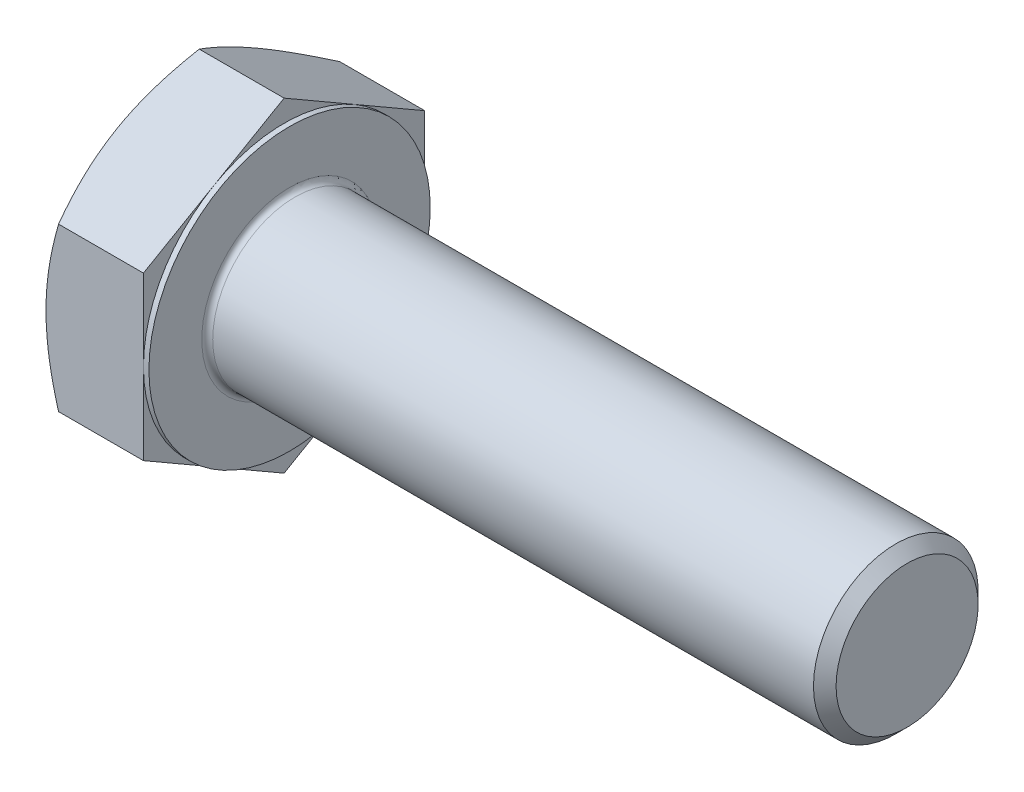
SolidWorks part; units mm, degrees
ref_plane "Front Plane" through (0, 0, 0) normal (0, 0, 1) x (1, 0, 0)
ref_plane "Top Plane" through (0, 0, 0) normal (0, 1, 0) x (1, 0, 0)
ref_plane "Right Plane" through (0, 0, 0) normal (1, 0, 0) x (0, 0, -1)
sketch "BaseHeadSke" plane through (0, 0, 0) normal (1, 0, 0) x (0, 0, -1)
  line L1 (20.5, 11.8357) -> (0, 23.6714)
  line L2 (0, 23.6714) -> (-20.5, 11.8357)
  line L3 (-20.5, 11.8357) -> (-20.5, -11.8357)
  line L4 (-20.5, -11.8357) -> (0, -23.6714)
  line L5 (0, -23.6714) -> (20.5, -11.8357)
  line L6 (20.5, -11.8357) -> (20.5, 11.8357)
  circle A0 centre (0, 0) radius 20.5 construction
  dimension "Width_flats" = 41
extrude "BaseHead" add sketch "BaseHeadSke" along normal blind 15
sketch "BodySke" plane through (0, 0, 0) normal (0, 0, 1) x (1, 0, 0)
  line L0 (0, 0) -> (105, 0)
  line L1 (105, 0) -> (105, 10.352)
  line L2 (105, 10.352) -> (103.352, 12)
  line L3 (103.352, 12) -> (0, 12)
  line L4 (0, 12) -> (0, 0)
  line L5 (15, 11.8357) -> (15, -11.8357) construction
  line L6 (0, 0) -> (159.3976, 0) construction
  line L7 (51, -84.3176) -> (51, 77.7215) construction
  line L8 (102, -21.5941) -> (102, 39.2994) construction
  dimension "Ang" = 45
  dimension "Length" = 90
  dimension "Diameter" = 24
  dimension "Minor_dia" = 20.704
  dimension "Thread_length" = 54
  dimension "Advance" = 3
revolve "BaseBody" add sketch "BodySke" angle 360 about L6
sketch "HeadChamferSke" plane through (0, 0, 0) normal (0, 0, 1) x (1, 0, 0)
  line L0 (1.831, 23.6714) -> (0, 23.6714)
  line L1 (0, 23.6714) -> (0, 20.5)
  line L2 (0, 20.5) -> (1.831, 23.6714)
  line L3 (0, 0) -> (120.9185, 0) construction
  dimension "D1" = 30
  dimension "Head_chamfer" = 41
revolve "HeadChamfer" cut sketch "HeadChamferSke" angle 360 about L3
sketch "BearingFaceSke" plane through (0, 0, 0) normal (0, 0, 1) x (1, 0, 0)
  line L0 (0, 0) -> (129.6443, 0) construction
  line L1 (14.2, 23.6714) -> (15, 23.6714)
  line L2 (14.2, 23.6714) -> (14.2, 20.5)
  line L3 (14.2, 20.5) -> (15, 20.5)
  line L4 (15, 23.6714) -> (15, 20.5)
  dimension "Bearing_height" = 0.8
  dimension "Dw" = 41
revolve "BearingFace" cut sketch "BearingFaceSke" angle 360 about L0
fillet "Fillet" radius 0.8 1 edges at (15, 0, -12)
sketch "ThdSchSke" plane through (0, 0, 0) normal (0, 0, 1) x (1, 0, 0)
  line L0 (101.0485, 13.9029) -> (101.0485, 12)
  line L1 (101.0485, 12) -> (102, 10.352)
  line L2 (102, 10.352) -> (102.9515, 12)
  line L3 (102.9515, 12) -> (102.9515, 13.9029)
  line L4 (102.9515, 13.9029) -> (101.0485, 13.9029)
  line L6 (0, 0) -> (141.9934, 0) construction
  line L7 (105, -10.352) -> (105, 10.352) construction
  dimension "D2" = 20.704
  dimension "D3" = 24
  dimension "Advance" = 3
revolve "ThreadSchematic" [suppressed] cut sketch "ThdSchSke" angle 360 about L6
pattern_linear "ThdSchPat" [suppressed] count 17 spacing 3 along (1, 0, 0)
equation "\"Thread_minor@ThreadCosmetic\" = \"Minor_dia@BodySke\""
equation "\"Thread_length@ThreadCosmetic\" = \"Thread_length@BodySke\""
equation "\"Head_chamfer@HeadChamferSke\" = \"Width_flats@BaseHeadSke\""
equation "\"D2@ThdSchSke\" = \"Minor_dia@BodySke\""
equation "\"D3@ThdSchSke\" = \"Diameter@BodySke\""
equation "\"Advance@ThdSchSke\" = \"Advance@BodySke\""
equation "\"D3@ThdSchPat\" = \"Advance@BodySke\""
equation "\"D1@ThdSchPat\" =  int( \"Thread_length@BodySke\"/\"Advance@BodySke\" )-1"
